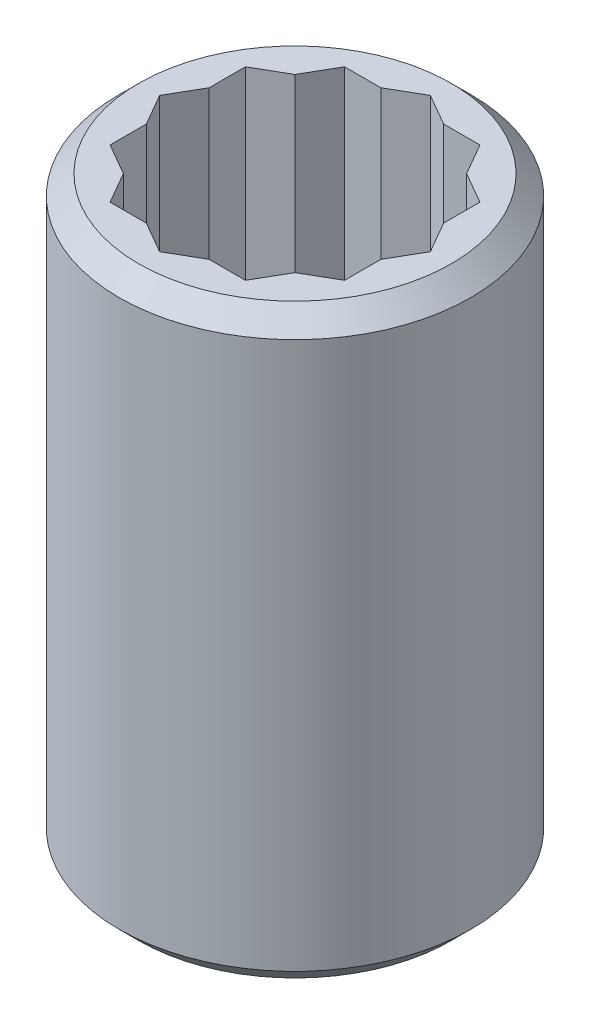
SolidWorks part; units mm, degrees
ref_plane "Front Plane" through (0, 0, 0) normal (0, 0, 1) x (1, 0, 0)
ref_plane "Top Plane" through (0, 0, 0) normal (0, 1, 0) x (1, 0, 0)
ref_plane "Right Plane" through (0, 0, 0) normal (1, 0, 0) x (0, 0, -1)
sketch "Sketch1" plane through (0, 0, 0) normal (0, 1, 0) x (1, 0, 0)
  circle A0 centre (0, 0) radius 9
extrude "Cylinder" add sketch "Sketch1" along normal blind 30
sketch "Sketch2" plane through (0, 30, 0) normal (0, 1, 0) x (-1, 0, 0)
  line L1 (-6.9282, 0) -> (-3.4641, -6)
  line L2 (-3.4641, -6) -> (3.4641, -6)
  line L3 (3.4641, -6) -> (6.9282, 0)
  line L4 (6.9282, 0) -> (3.4641, 6)
  line L5 (3.4641, 6) -> (-3.4641, 6)
  line L6 (-3.4641, 6) -> (-6.9282, 0)
  circle A0 centre (0, 0) radius 6 construction
extrude "6 Point" cut sketch "Sketch2" against normal blind 15
sketch "Sketch3" plane through (-3.872, 30, 9.385) normal (0, 1, 0) x (-1, 0, 0)
  line L1 (-9.872, -12.8491) -> (-3.872, -16.3132)
  line L2 (-3.872, -16.3132) -> (2.128, -12.8491)
  line L3 (2.128, -12.8491) -> (2.128, -5.9209)
  line L4 (2.128, -5.9209) -> (-3.872, -2.4568)
  line L5 (-3.872, -2.4568) -> (-9.872, -5.9209)
  line L6 (-9.872, -5.9209) -> (-9.872, -12.8491)
  line L7 (-3.872, -9.385) -> (-9.0682, -12.385) construction
  line L9 (-10.8002, -9.385) -> (-7.3361, -15.385) construction
  circle A0 centre (-3.872, -9.385) radius 6 construction
  circle A1 centre (-3.872, -9.385) radius 9 construction
extrude "12 Point" cut sketch "Sketch3" against normal up to surface (15 mm away)
sketch "Sketch4" plane through (0, 0, 0) normal (0, -1, 0) x (1, 0, 0)
  line L0 (-3, 3) -> (3, -3) construction
  line L1 (-3, 3) -> (3, 3)
  line L2 (-3, 3) -> (-3, -3)
  line L3 (-3, -3) -> (3, -3)
  line L4 (3, 3) -> (3, -3)
  dimension "DriveSquare" = 6
extrude "Drive" cut sketch "Sketch4" against normal up to next
chamfer "Chamfer1" distance 1 angle 45 2 edges at (0, 0, 9) (0, 30, 9)
equation "\"CylinderDiameter@Sketch1\" = \"AcrossFlats@Sketch2\" + 6"
